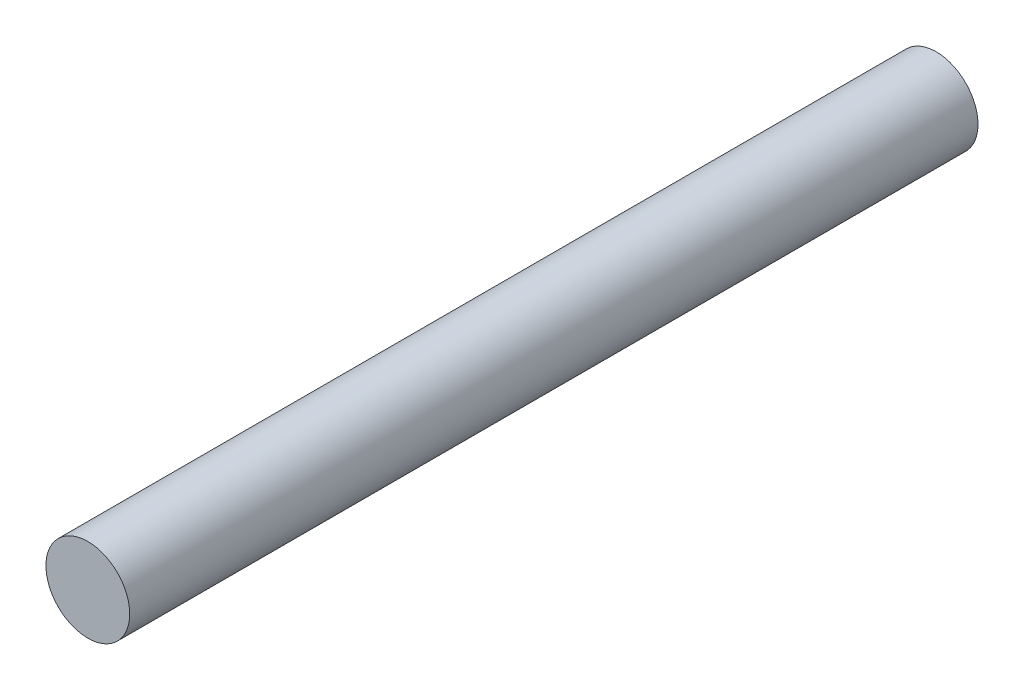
SolidWorks part; units mm, degrees
ref_plane "Front Plane" through (0, 0, 0) normal (0, 0, 1) x (1, 0, 0)
ref_plane "Top Plane" through (0, 0, 0) normal (0, 1, 0) x (1, 0, 0)
ref_plane "Right Plane" through (0, 0, 0) normal (1, 0, 0) x (0, 0, -1)
sketch "Sketch1" plane through (0, 0, 0) normal (0, 0, 1) x (1, 0, 0)
  circle A0 centre (0, 0) radius 8
  dimension "D1" = 16
extrude "Boss-Extrude1" add sketch "Sketch1" along normal blind 162
